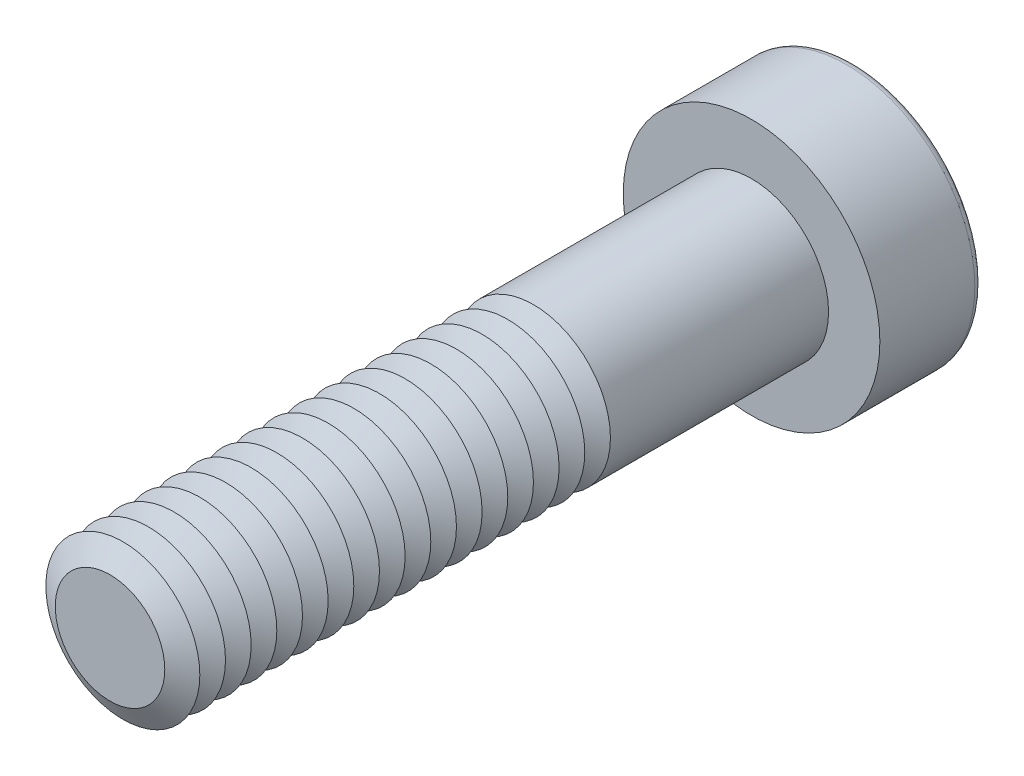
SolidWorks part; units mm, degrees
ref_plane "Front Plane" through (0, 0, 0) normal (0, 0, 1) x (1, 0, 0)
ref_plane "Top Plane" through (0, 0, 0) normal (0, 1, 0) x (1, 0, 0)
ref_plane "Right Plane" through (0, 0, 0) normal (1, 0, 0) x (0, 0, -1)
sketch "Sketch1" plane through (0, 0, 0) normal (0, 0, 1) x (1, 0, 0)
  circle A0 centre (0, 0) radius 3
  dimension "D1" = 6
extrude "Boss-Extrude1" add sketch "Sketch1" along normal blind 25
sketch "Sketch2" plane through (0, 0, 0) normal (0, 0, -1) x (-1, 0, 0)
  circle A0 centre (0, 0) radius 5
  dimension "D1" = 10
extrude "Boss-Extrude2" add sketch "Sketch2" along normal blind 4
sketch "Sketch3" plane through (0, 0, -4) normal (0, 0, -1) x (-1, 0, 0)
  line L1 (-1.1547, 2) -> (-2.3094, 0)
  line L2 (-2.3094, 0) -> (-1.1547, -2)
  line L3 (-1.1547, -2) -> (1.1547, -2)
  line L4 (1.1547, -2) -> (2.3094, 0)
  line L5 (2.3094, 0) -> (1.1547, 2)
  line L6 (1.1547, 2) -> (-1.1547, 2)
  circle A0 centre (0, 0) radius 2 construction
  dimension "D1" = 4
extrude "Cut-Extrude1" cut sketch "Sketch3" against normal blind 3
fillet "Fillet1" radius 0.3 1 edges at (-5, 0, -4)
sketch "Sketch4" plane through (0, 0, -1) normal (0, 0, -1) x (-1, 0, 0)
  line L0 (1.1547, -2) -> (2.3094, 0) construction
  circle A0 centre (0, 0) radius 2
extrude "Cut-Extrude2" cut sketch "Sketch4" against normal through all draft 60
sketch "Sketch5" plane through (0, 0, -4) normal (0, 0, -1) x (-1, 0, 0)
  circle A0 centre (0, 0) radius 2.3094
extrude "Cut-Extrude3" cut sketch "Sketch5" against normal through all draft 75
sketch "Sketch7" plane through (0, 0, 0) normal (1, 0, 0) x (0, 0, -1)
  line L25 (-25, 2.134) -> (-24.5, 3)
  line L26 (-25, 3) -> (-25, -3) construction
  line L27 (-24.5, 3) -> (-25.5, 3)
  line L28 (-25.5, 3) -> (-25, 2.134)
  line L29 (0, 3) -> (-25, 3) construction
  dimension "D1" = 1
revolve "Cut-Revolve1" cut sketch "Sketch7" angle 360 about axis through (0, 0, 25) along (0, 0, -1)
pattern_linear "LPattern1" count 17 spacing 1 along (0, 0, -1) of "Cut-Revolve1"
